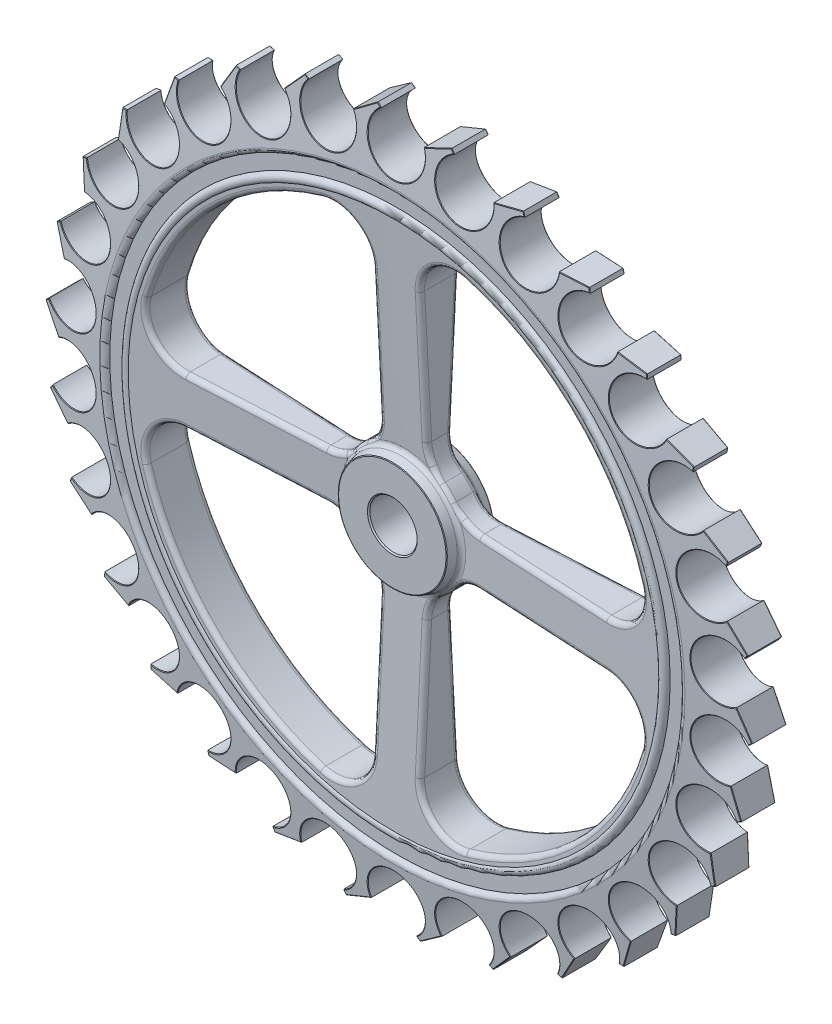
SolidWorks part; units mm, degrees
ref_plane "Спереди" through (0, 0, 0) normal (0, 0, 1) x (1, 0, 0)
ref_plane "Сверху" through (0, 0, 0) normal (0, 1, 0) x (1, 0, 0)
ref_plane "Справа" through (0, 0, 0) normal (1, 0, 0) x (0, 0, -1)
sketch "Эскиз1" plane through (0, 0, 0) normal (1, 0, 0) x (0, 0, -1)
  line L0 (-6.9967, 0) -> (6.2217, 0) construction
  line L1 (0, 10.0093) -> (0, -2.7457) construction
  line L2 (-5, 5) -> (5, 5)
  line L3 (-3.6, 74.7) -> (3.6, 74.7)
  line L4 (0, 5) -> (0, 74.7) construction
  line L5 (4, 60.7) -> (4, 57.7)
  line L6 (5, 5) -> (5, 88.7125) construction
  line L7 (3.6, 74.7) -> (4.9942, 61.8075)
  line L8 (5, 11.5) -> (3.2412, 11.9713)
  line L9 (5, 11.5) -> (5, 5)
  line L10 (2.5, 19.0212) -> (2.5, 8.0028) construction
  line L11 (2.5014, 12.9895) -> (4.758, 56.0477)
  line L12 (-5, 11.5) -> (-5, 5)
  line L13 (-5, 11.5) -> (-3.2412, 11.9713)
  line L14 (-2.5014, 12.9895) -> (-4.758, 56.0477)
  line L15 (-4, 60.7) -> (-4, 57.7)
  line L16 (-3.6, 74.7) -> (-4.9942, 61.8075)
  arc A0 (4, 60.7) -> (4.9942, 61.8075) centre (4, 61.7) ccw
  arc A1 (4.758, 56.0477) -> (4, 57.7) centre (4, 56.7) ccw
  arc A2 (2.5014, 12.9895) -> (3.2412, 11.9713) centre (3.5, 12.9372) ccw
  arc A3 (-2.5014, 12.9895) -> (-3.2412, 11.9713) centre (-3.5, 12.9372) cw
  arc A4 (-4.758, 56.0477) -> (-4, 57.7) centre (-4, 56.7) cw
  arc A5 (-4, 60.7) -> (-4.9942, 61.8075) centre (-4, 61.7) cw
  dimension "D8" = 2
  dimension "D1" = 5
  dimension "D2" = 5
  dimension "D3" = 74.7
  dimension "D4" = 3.6
  dimension "D5" = 3
  dimension "D6" = 4
  dimension "D7" = 14
  dimension "D9" = 11.5
  dimension "D10" = 15
  dimension "D11" = 2.5
  dimension "D12" = 3
revolve "Повернуть1" add sketch "Эскиз1" angle 360 about L0
sketch "Эскиз2" plane through (0, 0, 0) normal (0, 0, 1) x (1, 0, 0)
  line L0 (0, 79.1548) -> (0, 0) construction
  line L1 (0, 0) -> (86.0368, 0) construction
  line L2 (5, 44.4979) -> (5, 16.2481)
  line L3 (44.4979, 5) -> (16.2481, 5)
  line L4 (44.4979, -5) -> (16.2481, -5)
  line L5 (5, -44.4979) -> (5, -16.2481)
  line L6 (-5, -44.4979) -> (-5, -16.2481)
  line L7 (-44.4979, -5) -> (-16.2481, -5)
  line L8 (-44.4979, 5) -> (-16.2481, 5)
  line L9 (-5, 44.4979) -> (-5, 16.2481)
  line L10 (0, 0) -> (15.531, 73.0676) construction
  line L11 (11.1239, 73.8671) -> (5.5822, 71.3998)
  line L12 (11.1239, 73.8671) -> (11.7116, 73.0581)
  line L13 (26.2386, 69.9402) -> (20.3051, 68.6789)
  line L14 (26.2386, 69.9402) -> (26.6454, 69.0266)
  line L15 (40.2066, 62.9565) -> (34.1405, 62.9565)
  line L16 (40.2066, 62.9565) -> (40.4145, 61.9783)
  line L17 (52.4174, 53.2213) -> (46.4838, 54.4825)
  line L18 (52.4174, 53.2213) -> (52.4174, 52.2213)
  line L19 (62.3373, 41.1601) -> (56.7956, 43.6274)
  line L20 (62.3373, 41.1601) -> (62.1294, 40.182)
  line L21 (69.5327, 27.3) -> (64.6251, 30.8656)
  line L22 (69.5327, 27.3) -> (69.126, 26.3865)
  line L23 (73.6893, 12.2468) -> (69.6302, 16.7548)
  line L24 (73.6893, 12.2468) -> (73.1015, 11.4378)
  line L25 (74.6252, -3.3417) -> (71.5922, 1.9117)
  line L26 (74.6252, -3.3417) -> (73.8821, -4.0108)
  line L27 (72.2997, -18.7841) -> (70.4252, -13.0149)
  line L28 (72.2997, -18.7841) -> (71.4337, -19.2841)
  line L29 (66.8143, -33.4056) -> (66.1803, -27.3727)
  line L30 (66.8143, -33.4056) -> (65.8633, -33.7146)
  line L31 (58.4089, -46.5671) -> (59.0429, -40.5342)
  line L32 (58.4089, -46.5671) -> (57.4143, -46.6716)
  line L33 (47.4506, -57.6934) -> (49.3252, -51.9242)
  line L34 (47.4506, -57.6934) -> (46.4561, -57.5889)
  line L35 (34.4186, -66.2982) -> (37.4517, -61.0448)
  line L36 (34.4186, -66.2982) -> (33.4675, -65.9892)
  line L37 (19.8823, -72.0054) -> (23.9413, -67.4974)
  line L38 (19.8823, -72.0054) -> (19.0163, -71.5054)
  line L39 (4.4771, -74.5657) -> (9.3846, -71.0001)
  line L40 (4.4771, -74.5657) -> (3.7339, -73.8966)
  line L41 (-11.1239, -73.8671) -> (-5.5822, -71.3998)
  line L42 (-11.1239, -73.8671) -> (-11.7116, -73.0581)
  line L43 (-26.2386, -69.9402) -> (-20.3051, -68.6789)
  line L44 (-26.2386, -69.9402) -> (-26.6454, -69.0266)
  line L45 (-40.2066, -62.9565) -> (-34.1405, -62.9565)
  line L46 (-40.2066, -62.9565) -> (-40.4145, -61.9783)
  line L47 (-52.4174, -53.2213) -> (-46.4838, -54.4825)
  line L48 (-52.4174, -53.2213) -> (-52.4174, -52.2213)
  line L49 (-62.3373, -41.1601) -> (-56.7956, -43.6274)
  line L50 (-62.3373, -41.1601) -> (-62.1294, -40.182)
  line L51 (-69.5327, -27.3) -> (-64.6251, -30.8656)
  line L52 (-69.5327, -27.3) -> (-69.126, -26.3865)
  line L53 (-73.6893, -12.2468) -> (-69.6302, -16.7548)
  line L54 (-73.6893, -12.2468) -> (-73.1015, -11.4378)
  line L55 (-74.6252, 3.3417) -> (-71.5922, -1.9117)
  line L56 (-74.6252, 3.3417) -> (-73.8821, 4.0108)
  line L57 (-72.2997, 18.7841) -> (-70.4252, 13.0149)
  line L58 (-72.2997, 18.7841) -> (-71.4337, 19.2841)
  line L59 (-66.8143, 33.4056) -> (-66.1803, 27.3727)
  line L60 (-66.8143, 33.4056) -> (-65.8633, 33.7146)
  line L61 (-58.4089, 46.5671) -> (-59.0429, 40.5342)
  line L62 (-58.4089, 46.5671) -> (-57.4143, 46.6716)
  line L63 (-47.4506, 57.6934) -> (-49.3252, 51.9242)
  line L64 (-47.4506, 57.6934) -> (-46.4561, 57.5889)
  line L65 (-34.4186, 66.2982) -> (-37.4517, 61.0448)
  line L66 (-34.4186, 66.2982) -> (-33.4675, 65.9892)
  line L67 (-19.8823, 72.0054) -> (-23.9413, 67.4974)
  line L68 (-19.8823, 72.0054) -> (-19.0163, 71.5054)
  line L69 (-4.4771, 74.5657) -> (-9.3846, 71.0001)
  line L70 (-4.4771, 74.5657) -> (-3.7339, 73.8966)
  arc A0 (10.3037, 7.9268) -> (7.9268, 10.3037) centre (0, 0) ccw
  arc A1 (52.1769, 15.2434) -> (15.2434, 52.1769) centre (0, 0) ccw
  arc A2 (15.2434, 52.1769) -> (5, 44.4979) centre (13, 44.4979) ccw
  arc A3 (44.4979, 5) -> (52.1769, 15.2434) centre (44.4979, 13) ccw
  arc A4 (5, 16.2481) -> (7.9268, 10.3037) centre (12.5, 16.2481) ccw
  arc A5 (10.3037, 7.9268) -> (16.2481, 5) centre (16.2481, 12.5) ccw
  arc A6 (7.9268, -10.3037) -> (10.3037, -7.9268) centre (0, 0) ccw
  arc A7 (15.2434, -52.1769) -> (52.1769, -15.2434) centre (0, 0) ccw
  arc A8 (52.1769, -15.2434) -> (44.4979, -5) centre (44.4979, -13) ccw
  arc A9 (5, -44.4979) -> (15.2434, -52.1769) centre (13, -44.4979) ccw
  arc A10 (16.2481, -5) -> (10.3037, -7.9268) centre (16.2481, -12.5) ccw
  arc A11 (7.9268, -10.3037) -> (5, -16.2481) centre (12.5, -16.2481) ccw
  arc A12 (-10.3037, -7.9268) -> (-7.9268, -10.3037) centre (0, 0) ccw
  arc A13 (-52.1769, -15.2434) -> (-15.2434, -52.1769) centre (0, 0) ccw
  arc A14 (-15.2434, -52.1769) -> (-5, -44.4979) centre (-13, -44.4979) ccw
  arc A15 (-44.4979, -5) -> (-52.1769, -15.2434) centre (-44.4979, -13) ccw
  arc A16 (-5, -16.2481) -> (-7.9268, -10.3037) centre (-12.5, -16.2481) ccw
  arc A17 (-10.3037, -7.9268) -> (-16.2481, -5) centre (-16.2481, -12.5) ccw
  arc A18 (-7.9268, 10.3037) -> (-10.3037, 7.9268) centre (0, 0) ccw
  arc A19 (-15.2434, 52.1769) -> (-52.1769, 15.2434) centre (0, 0) ccw
  arc A20 (-52.1769, 15.2434) -> (-44.4979, 5) centre (-44.4979, 13) ccw
  arc A21 (-5, 44.4979) -> (-15.2434, 52.1769) centre (-13, 44.4979) ccw
  arc A22 (-16.2481, 5) -> (-10.3037, 7.9268) centre (-16.2481, 12.5) ccw
  arc A23 (-7.9268, 10.3037) -> (-5, 16.2481) centre (-12.5, 16.2481) ccw
  circle A24 centre (0, 0) radius 69.2 construction
  circle A25 centre (0, 0) radius 74.7 construction
  arc A26 (11.7116, 73.0581) -> (20.3051, 68.6789) centre (14.3875, 67.6878) ccw
  circle A27 centre (0, 69.2) radius 6 construction
  circle A28 centre (0, 0) radius 71.6177 construction
  arc A29 (26.6454, 69.0266) -> (34.1405, 62.9565) centre (28.1462, 63.2173) ccw
  arc A30 (40.4145, 61.9783) -> (46.4838, 54.4825) centre (40.6747, 55.984) ccw
  arc A31 (52.4174, 52.2213) -> (56.7956, 43.6274) centre (51.4256, 46.3038) ccw
  arc A32 (62.1294, 40.182) -> (64.6251, 30.8656) centre (59.929, 34.6) ccw
  arc A33 (69.126, 26.3865) -> (69.6302, 16.7548) centre (65.8131, 21.384) ccw
  arc A34 (73.1015, 11.4378) -> (71.5922, 1.9117) centre (68.8209, 7.2334) ccw
  arc A35 (73.8821, -4.0108) -> (70.4252, -13.0149) centre (68.8209, -7.2334) ccw
  arc A36 (71.4337, -19.2841) -> (66.1803, -27.3727) centre (65.8131, -21.384) ccw
  arc A37 (65.8633, -33.7146) -> (59.0429, -40.5342) centre (59.929, -34.6) ccw
  arc A38 (57.4143, -46.6716) -> (49.3252, -51.9242) centre (51.4256, -46.3038) ccw
  arc A39 (46.4561, -57.5889) -> (37.4517, -61.0448) centre (40.6747, -55.984) ccw
  arc A40 (33.4675, -65.9892) -> (23.9413, -67.4974) centre (28.1462, -63.2173) ccw
  arc A41 (19.0163, -71.5054) -> (9.3846, -71.0001) centre (14.3875, -67.6878) ccw
  arc A42 (3.7339, -73.8966) -> (-5.5822, -71.3998) centre (0, -69.2) ccw
  arc A43 (-11.7116, -73.0581) -> (-20.3051, -68.6789) centre (-14.3875, -67.6878) ccw
  arc A44 (-26.6454, -69.0266) -> (-34.1405, -62.9565) centre (-28.1462, -63.2173) ccw
  arc A45 (-40.4145, -61.9783) -> (-46.4838, -54.4825) centre (-40.6747, -55.984) ccw
  arc A46 (-52.4174, -52.2213) -> (-56.7956, -43.6274) centre (-51.4256, -46.3038) ccw
  arc A47 (-62.1294, -40.182) -> (-64.6251, -30.8656) centre (-59.929, -34.6) ccw
  arc A48 (-69.126, -26.3865) -> (-69.6302, -16.7548) centre (-65.8131, -21.384) ccw
  arc A49 (-73.1015, -11.4378) -> (-71.5922, -1.9117) centre (-68.8209, -7.2334) ccw
  arc A50 (-73.8821, 4.0108) -> (-70.4252, 13.0149) centre (-68.8209, 7.2334) ccw
  arc A51 (-71.4337, 19.2841) -> (-66.1803, 27.3727) centre (-65.8131, 21.384) ccw
  arc A52 (-65.8633, 33.7146) -> (-59.0429, 40.5342) centre (-59.929, 34.6) ccw
  arc A53 (-57.4143, 46.6716) -> (-49.3252, 51.9242) centre (-51.4256, 46.3038) ccw
  arc A54 (-46.4561, 57.5889) -> (-37.4517, 61.0448) centre (-40.6747, 55.984) ccw
  arc A55 (-33.4675, 65.9892) -> (-23.9413, 67.4974) centre (-28.1462, 63.2173) ccw
  arc A56 (-19.0163, 71.5054) -> (-9.3846, 71.0001) centre (-14.3875, 67.6878) ccw
  arc A57 (-3.7339, 73.8966) -> (5.5822, 71.3998) centre (0, 69.2) ccw
  dimension "D1" = 26
  dimension "D4" = 108.716
  dimension "D5" = 16
  dimension "D6" = 7.5
  dimension "D9" = 138.4
  dimension "D11" = 12
  dimension "D2" = 5
  dimension "D3" = 5
  dimension "D8" = 10
  dimension "D10" = 12
  dimension "D12" = 126
  dimension "D13" = 258
  dimension "D14" = 1
  dimension "D7" = 4
  dimension "D15" = 30
extrude "Вырез-Вытянуть1" cut sketch "Эскиз2" along normal mid plane 10 flip side to cut
fillet "Скругление1" radius 1 64 edges at (38.4369, -38.4369, -4.6694) (51.2872, -8.7685, -4.5475) (12.1471, -6.2205, -2.5358) (9.1924, -9.1924, -2.5019) (5.4226, -13.7659, -2.596) (-50.4759, -7.6836, -4.4964) (-38.4369, -38.4369, -4.6694) (-8.7685, -51.2872, -4.5475) (-6.2205, -12.1471, -2.5358) (-9.1924, -9.1924, -2.5019) (-13.7659, -5.4226, -2.596) (-12.1471, 6.2205, -2.5358) (-9.1924, 9.1924, -2.5019) (-5.4226, 13.7659, -2.596) (-7.6836, 50.4759, -4.4964) (-38.4369, 38.4369, -4.6694) (-51.2872, 8.7685, -4.5475) (50.4759, 7.6836, -4.4964) (38.4369, 38.4369, -4.6694) (8.7685, 51.2872, -4.5475) (6.2205, 12.1471, -2.5358) (9.1924, 9.1924, -2.5019) (13.7659, 5.4226, -2.596) (50.4759, -7.6836, 4.4964) (38.4369, -38.4369, 4.6694) (8.7685, -51.2872, 4.5475) (6.2205, -12.1471, 2.5358) (9.1924, -9.1924, 2.5019) (13.7659, -5.4226, 2.596) (12.1471, 6.2205, 2.5358) (9.1924, 9.1924, 2.5019) (5.4226, 13.7659, 2.596) (7.6836, 50.4759, 4.4964) (38.4369, 38.4369, 4.6694) (51.2872, 8.7685, 4.5475) (-12.1471, -6.2205, 2.5358) (-9.1924, -9.1924, 2.5019) (-5.4226, -13.7659, 2.596) (-7.6836, -50.4759, 4.4964) (-38.4369, -38.4369, 4.6694) (-51.2872, -8.7685, 4.5475) (-50.4759, 7.6836, 4.4964) (-38.4369, 38.4369, 4.6694) (-8.7685, 51.2872, 4.5475) (-6.2205, 12.1471, 2.5358) (-9.1924, 9.1924, 2.5019) (-13.7659, 5.4226, 2.596) (7.6836, -50.4759, -4.4964)
chamfer "Фаска1" distance 0.25 angle 45 2 edges at (5, 0, 5) (5, 0, -5)
chamfer "Фаска2" distance 0.1 angle 45 182 edges at (-2.5488, 63.7683, -4.7767) (-15.7512, 61.8448, -4.7767) (-27.7175, 57.2327, -4.8013) (-39.0111, 50.2192, -4.8013) (-48.5998, 41.0109, -4.8013) (-56.5002, 29.6762, -4.7766) (-61.435, 17.2813, -4.7766) (-63.6854, 4.1307, -4.7767) (-63.1525, -9.2004, -4.7767) (-59.8478, -20.7393, -4.8285) (-54.0219, -33.5481, -4.8013) (-45.8663, -44.0468, -4.8013) (-35.4179, -53.0916, -4.7764) (-23.6082, -59.2923, -4.7766) (-10.765, -62.9048, -4.7767) (2.5488, -63.7683, -4.7767) (15.7512, -61.8448, -4.7767) (27.7175, -57.2327, -4.8013) (39.0111, -50.2192, -4.8013) (48.5998, -41.0109, -4.8013) (56.5002, -29.6762, -4.7766) (61.435, -17.2813, -4.7766) (63.6854, -4.1307, -4.7767) (63.1525, 9.2004, -4.7767) (59.8478, 20.7393, -4.8285) (54.0219, 33.5481, -4.8013) (45.8663, 44.0468, -4.8013) (35.4179, 53.0916, -4.7764) (23.6082, 59.2923, -4.7766) (10.765, 62.9048, -4.7767) (24.9431, 58.1439, 4.8362) (36.7472, 51.4481, 4.841) (46.6406, 42.6839, 4.841) (54.4959, 32.0541, 4.841) (59.9694, 20.0234, 4.841) (62.821, 7.2542, 4.8395) (63.4563, -4.5462, 4.7983) (60.9967, -17.806, 4.8066) (55.007, -31.1686, 4.841) (47.5139, -41.7543, 4.8378) (37.5749, -50.8468, 4.841) (26.1822, -57.5479, 4.841) (15.0288, -61.7222, 4.8084) (1.3927, -63.3639, 4.8242) (-11.3325, -62.5238, 4.8066) (-24.9431, -58.1439, 4.8362) (-36.7472, -51.4481, 4.841) (-46.6406, -42.6839, 4.841) (-54.4959, -32.0541, 4.841) (-59.9694, -20.0234, 4.841) (-62.821, -7.2542, 4.8395) (-63.4563, 4.5462, 4.7983) (-60.9967, 17.806, 4.8066) (-55.007, 31.1686, 4.841) (-47.5139, 41.7543, 4.8378) (-37.5749, 50.8468, 4.841) (-26.1822, 57.5479, 4.841) (-15.0288, 61.7222, 4.8084) (-1.3927, 63.3639, 4.8242) (11.3325, 62.5238, 4.8066) (11.5, 0, -5) (11.5, 0, 5)
